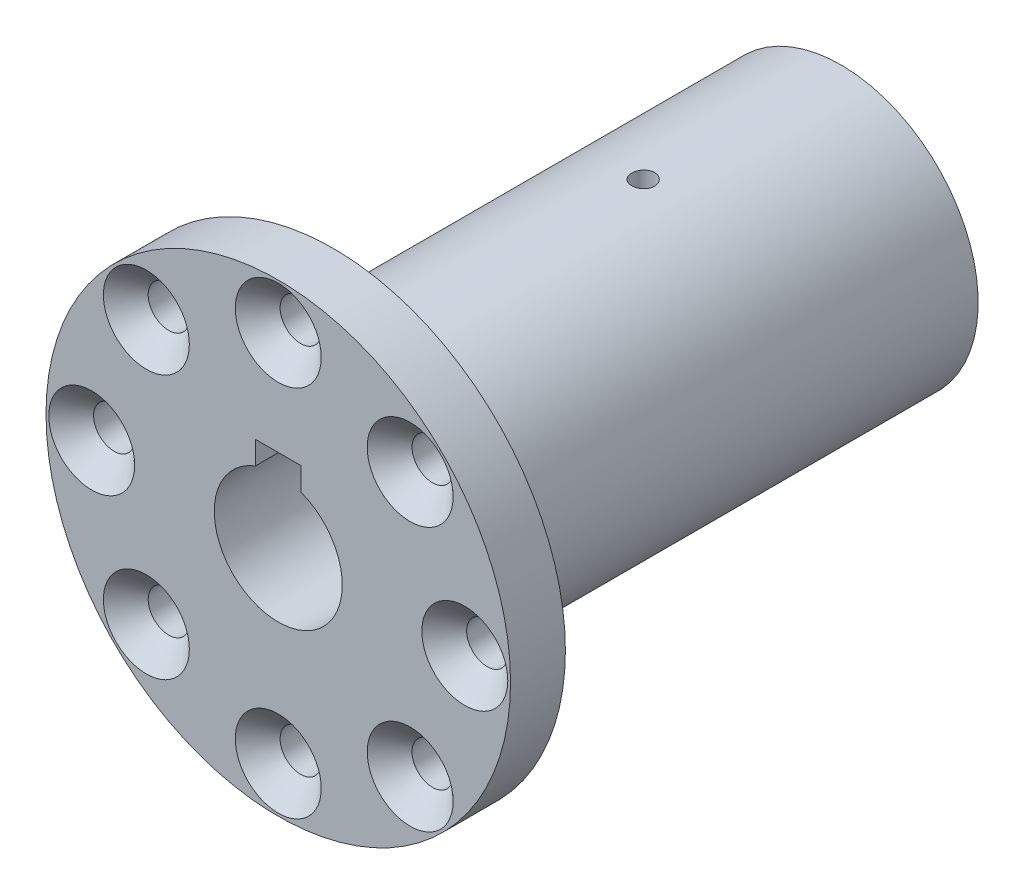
SolidWorks part; units mm, degrees
ref_plane "Front Plane" through (0, 0, 0) normal (0, 0, 1) x (1, 0, 0)
ref_plane "Top Plane" through (0, 0, 0) normal (0, 1, 0) x (1, 0, 0)
ref_plane "Right Plane" through (0, 0, 0) normal (1, 0, 0) x (0, 0, -1)
ref_plane "Plane1" through (0, 0, 0) normal (0, -1, 0) x (1, 0, 0)
sketch "Sketch1" plane through (0, 0, 0) normal (0, -1, 0) x (1, 0, 0)
  line L0 (25.4, 61.54) -> (0, 61.54)
  line L1 (0, 61.54) -> (0, 55.54)
  line L2 (0, 55.54) -> (25.4, 55.54)
  line L3 (25.4, 55.54) -> (25.4, 61.54)
  line L4 (0, 61.54) -> (0, 55.54) construction
revolve "Revolve1" add sketch "Sketch1" angle 360 about L4
sketch "Sketch2" plane through (0, 0, 55.54) normal (0, 0, -1) x (-1, 0, 0)
  circle A0 centre (0, 0) radius 15
extrude "Boss-Extrude1" add sketch "Sketch2" along normal blind 55.54
sketch "Sketch3" plane through (0, 0, 0) normal (0, 0, -1) x (-1, 0, 0)
  line L0 (2.5, 9.0585) -> (-2.5, 9.0585)
  line L1 (-2.5, 9.0585) -> (-2.5, 6.5383)
  line L2 (2.5, 6.5383) -> (2.5, 9.0585)
  arc A0 (-2.5, 6.5383) -> (2.5, 6.5383) centre (0, 0) cw
extrude "Cut-Extrude1" cut sketch "Sketch3" against normal through all
sketch "Sketch4" plane through (0, 0, 0) normal (0, -1, 0) x (1, 0, 0)
  line L0 (7, 61.54) -> (0, 61.54)
  line L1 (0, 61.54) -> (0, 0)
  line L2 (0, 0) -> (7, 0)
  line L3 (7, 0) -> (7, 61.54)
  line L4 (0, 61.54) -> (0, 0) construction
revolve "Cut-Revolve1" cut sketch "Sketch4" angle 360 about L4
hole_wizard "#2 Clearance Hole1" positions "Sketch6" profile "Sketch5" hole size "#2" standard "ANSI Inch"
sketch "Sketch6" plane through (0, 0, 0) normal (0, 0, -1) x (-1, 0, 0)
  point P0 (-11.5, 0)
  point P1 (-5.75, -9.9593)
  point P2 (5.75, -9.9593)
  point P3 (11.5, 0)
  point P4 (5.75, 9.9593)
  point P5 (-5.75, 9.9593)
sketch "Sketch5" plane through (11.5, 0, 0) normal (1, 0, 0) x (0, 1, 0)
  line L0 (0, 0) -> (0, 12)
  line L1 (0, 12) -> (1.25, 12)
  line L2 (1.25, 12) -> (1.25, 0)
  line L5 (1.25, 0) -> (0, 0)
  line L10 (0, 12) -> (-1.25, 12) construction
  line L11 (0, -6.35) -> (0, 107.95) construction
  dimension "Hole Dia." = 2.5
  dimension "Hole Depth" = 12
  dimension "Drill Angle" = 180
hole_wizard "#2 Clearance Hole2" positions "Sketch8" profile "Sketch7" hole size "#2" standard "ANSI Inch"
sketch "Sketch8" plane through (0, 9.0585, 0) normal (0, -1, 0) x (-1, 0, 0)
  point P0 (0, -21.64)
sketch "Sketch7" plane through (0, 9.0585, 21.64) normal (1, 0, 0) x (0, 0, -1)
  line L0 (0, 0) -> (0, 16.3415)
  line L1 (0, 16.3415) -> (1.25, 16.3415)
  line L2 (1.25, 16.3415) -> (1.25, 0)
  line L5 (1.25, 0) -> (0, 0)
  line L11 (0, -6.35) -> (0, 107.95) construction
  dimension "Thru Hole Dia." = 2.5
  dimension "Thru Hole Depth" = 16.3415
hole_wizard "CSK for #8 Flat Head Machine Screw (100)1" positions "Sketch10" profile "Sketch9" countersink size "#8" standard "ANSI Inch"
sketch "Sketch10" plane through (0, 0, 61.54) normal (0, 0, 1) x (1, 0, 0)
  point P0 (0, 20.4)
  point P1 (14.425, 14.425)
  point P2 (20.4, 0)
  point P3 (14.425, -14.425)
  point P4 (0, -20.4)
  point P5 (-14.425, -14.425)
  point P6 (-20.4, 0)
  point P7 (-14.425, 14.425)
sketch "Sketch9" plane through (0, 20.4, 61.54) normal (1, 0, 0) x (0, -1, 0)
  line L0 (0, 0) -> (0, 61.54)
  line L1 (0, 61.54) -> (2.25, 61.54)
  line L2 (2.25, 61.54) -> (2.25, 2.45)
  line L3 (2.25, 2.45) -> (4.7, 0)
  line L5 (4.7, 0) -> (0, 0)
  line L6 (-2.25, 2.45) -> (-4.7, 0) construction
  line L11 (0, -6.35) -> (0, 107.95) construction
  dimension "Thru Hole Dia." = 4.5
  dimension "Thru Hole Depth" = 61.54
  dimension "Near C'Sink Dia." = 9.4
  dimension "Near C'Sink Angle" = 90
